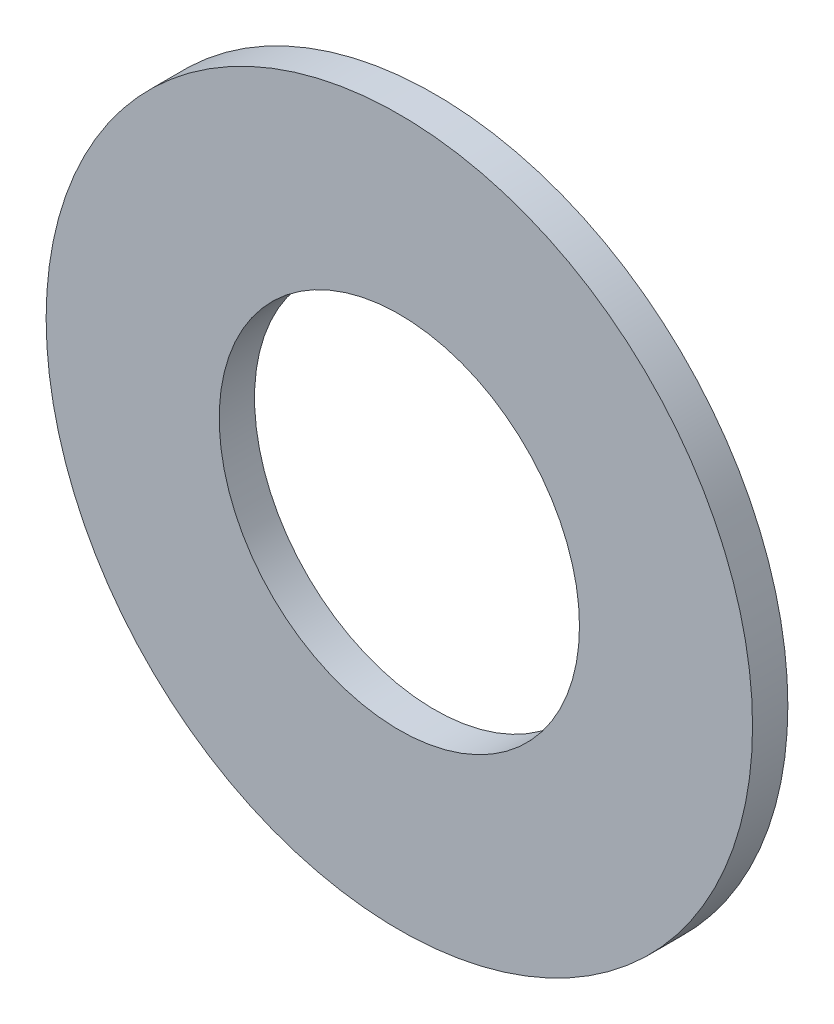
SolidWorks part; units mm, degrees
ref_plane "Plan1" through (0, 0, 0) normal (0, 0, 1) x (1, 0, 0)
ref_plane "Plan2" through (0, 0, 0) normal (0, 1, 0) x (1, 0, 0)
ref_plane "Plan3" through (0, 0, 0) normal (1, 0, 0) x (0, 0, -1)
sketch "Esquisse1" plane through (0, 0, 0) normal (0, 0, 1) x (1, 0, 0)
  line L0 (0, 10) -> (0, -10) construction
  line L1 (-10, 0) -> (10, 0) construction
  circle A0 centre (0, 0) radius 5.1
  circle A1 centre (0, 0) radius 10
  dimension "D1" = 10.2
  dimension "D2" = 20
extrude "Base-Extrusion" add sketch "Esquisse1" along normal blind 1
